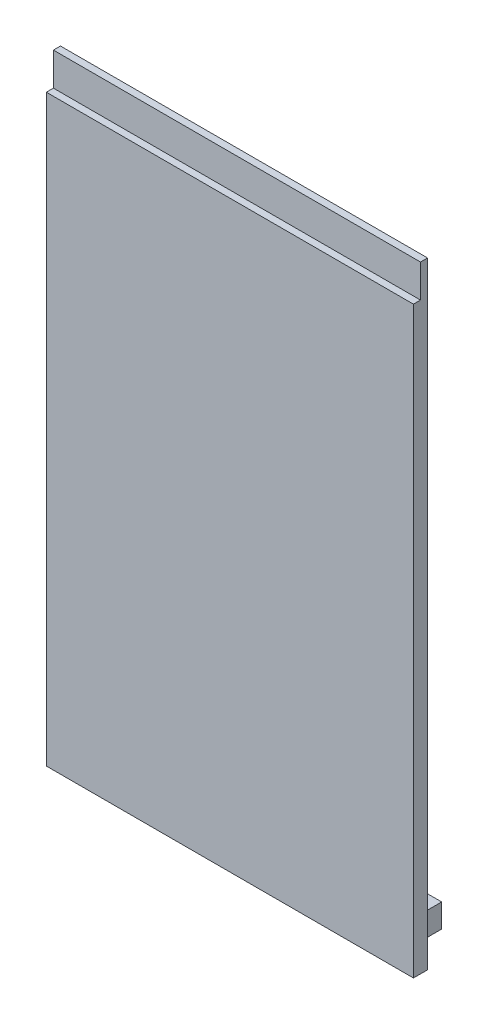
SolidWorks part; units mm, degrees
ref_plane "Front Plane" through (0, 0, 0) normal (0, 0, 1) x (1, 0, 0)
ref_plane "Top Plane" through (0, 0, 0) normal (0, 1, 0) x (1, 0, 0)
ref_plane "Right Plane" through (0, 0, 0) normal (1, 0, 0) x (0, 0, -1)
sketch "Sketch1" plane through (0, 0, 0) normal (0, 0, 1) x (1, 0, 0)
  line L1 (-39, 124.5) -> (39, 124.5)
  line L2 (-39, 124.5) -> (-39, -124.5)
  line L3 (-39, -124.5) -> (39, -124.5)
  line L4 (39, 124.5) -> (39, -124.5)
  line L5 (-39, 124.5) -> (39, -124.5) construction
  line L6 (-39, -124.5) -> (39, 124.5) construction
  point P0 (0, 0)
  dimension "D1" = 249
  dimension "D2" = 78
extrude "Boss-Extrude1" add sketch "Sketch1" along normal blind 3
sketch "Sketch3" plane through (-39, 0, 0) normal (-1, 0, 0) x (0, 0, 1)
  line L0 (3, -124.5) -> (0, -124.5)
  line L1 (0, -124.5) -> (0, -121.5)
  line L2 (0, 124.5) -> (3, 124.5)
  line L3 (3, 124.5) -> (3, -124.5)
  line L4 (0, -121.5) -> (-6, -121.5)
  line L5 (-6, -121.5) -> (-6, -116.5)
  line L6 (-6, -116.5) -> (0, -116.5)
  line L7 (0, 121.5) -> (-6, 121.5)
  line L8 (-6, 121.5) -> (-6, 116.5)
  line L9 (-6, 116.5) -> (0, 116.5)
  line L10 (0, -116.5) -> (0, 116.5)
  line L11 (0, 121.5) -> (0, 124.5)
  dimension "D1" = 3
  dimension "D2" = 3
  dimension "D3" = 6
  dimension "D4" = 5
extrude "Boss-Extrude2" add sketch "Sketch3" against normal through all
sketch "Sketch5" plane through (0, -121.5, 0) normal (0, -1, 0) x (-1, 0, 0)
  line L0 (56.4821, 0) -> (-56.4821, 0) construction
  line L1 (39, 6) -> (39, 0)
  line L2 (39, 0) -> (36, 0)
  line L3 (36, 0) -> (36, 6)
  line L4 (-39, 6) -> (39, 6) construction
  line L5 (36, 6) -> (39, 6)
  line L6 (-39, 0) -> (-39, 6)
  line L7 (-39, 6) -> (-36, 6)
  line L8 (-36, 6) -> (-36, 0)
  line L9 (-36, 0) -> (-39, 0)
  point P4 (0, 0)
  dimension "D1" = 3
  dimension "D2" = 3
extrude "Cut-Extrude1" cut sketch "Sketch5" against normal through all
sketch "Sketch6" plane through (0, -121.5, 0) normal (0, -1, 0) x (1, 0, 0)
  line L2 (36, 0) -> (-36, 0) construction
  line L3 (-36, -6) -> (-36, 0) construction
  line L4 (36, 0) -> (36, -6) construction
  circle A0 centre (-31, -3) radius 1.5
  circle A1 centre (31, -3) radius 1.5
  dimension "D1" = 3
  dimension "D2" = 3
  dimension "D4" = 5
  dimension "D3" = 5
  dimension "D5" = 3
extrude "Cut-Extrude2" cut sketch "Sketch6" against normal through all
sketch "Sketch7" plane through (0, 0, 3) normal (0, 0, 1) x (1, 0, 0)
  line L0 (0, -162.0343) -> (0, 162.0343) construction
  line L1 (39, 124.5) -> (-39, 124.5) construction
  circle A0 centre (0, 99.5) radius 5
  point P4 (0, 0)
  dimension "D1" = 10
  dimension "D2" = 25
extrude "Cut-Extrude3" cut sketch "Sketch7" against normal through all
sketch "Sketch8" plane through (-39, 0, 0) normal (-1, 0, 0) x (0, 0, 1)
  line L0 (0, 132.8423) -> (0, 121.5) construction
  line L1 (0, 124.5) -> (3, 124.5)
  line L2 (3, 124.5) -> (3, -0.5)
  line L3 (3, 124.5) -> (3, -124.5) construction
  line L4 (3, -0.5) -> (1.5, -0.5)
  line L5 (1.5, -0.5) -> (1.5, 6.5)
  line L6 (1.5, 6.5) -> (0, 6.5)
  line L7 (0, 6.5) -> (0, 116.5)
  line L9 (0, 121.5) -> (-6, 121.5)
  line L10 (-6, 121.5) -> (-6, 116.5)
  line L11 (-6, 116.5) -> (0, 116.5)
  line L12 (0, 121.5) -> (0, 124.5)
  line L13 (0, 116.5) -> (0, -139.7561) construction
  dimension "D1" = 125
  dimension "D2" = 7
  dimension "D3" = 1.5
extrude "Cut-Extrude4" cut sketch "Sketch8" against normal through all
